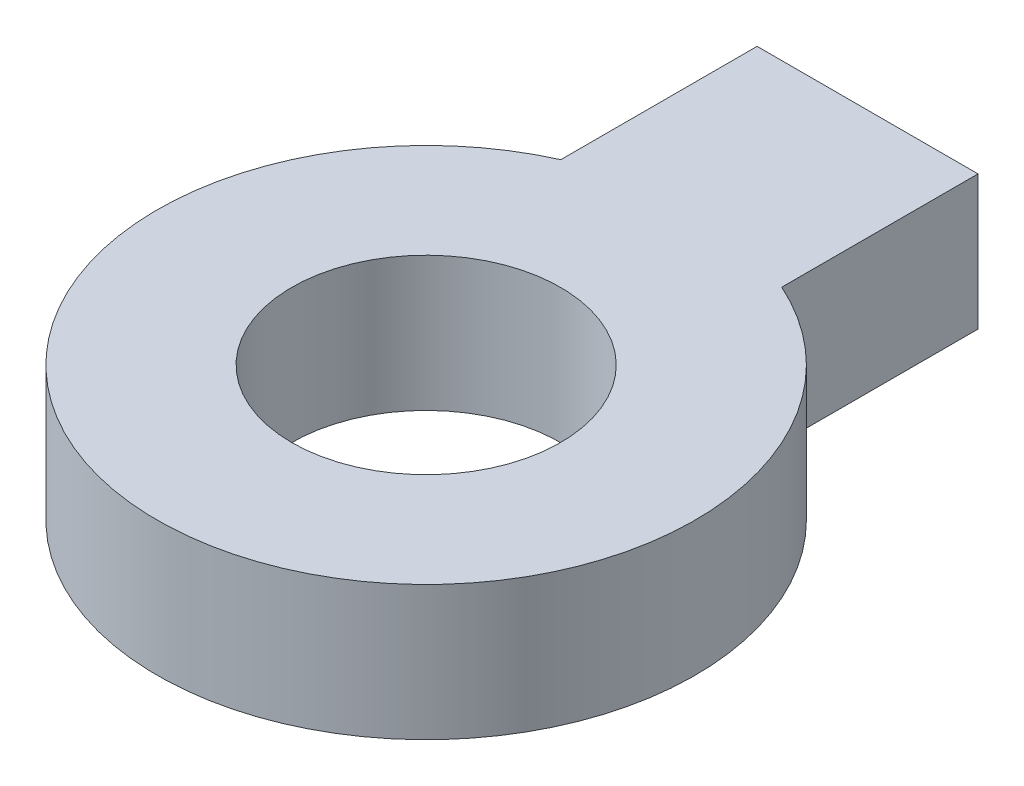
SolidWorks part; units mm, degrees
ref_plane "Front Plane" through (0, 0, 0) normal (0, 0, 1) x (1, 0, 0)
ref_plane "Top Plane" through (0, 0, 0) normal (0, 1, 0) x (1, 0, 0)
ref_plane "Right Plane" through (0, 0, 0) normal (1, 0, 0) x (0, 0, -1)
sketch "Sketch1" plane through (0, 0, 0) normal (0, 1, 0) x (1, 0, 0)
  line L0 (-2.6085, 10.4244) -> (2.6085, 10.4244)
  line L2 (-2.6085, 10.4244) -> (-2.6085, 5.7895)
  line L4 (2.6085, 10.4244) -> (2.6085, 5.7895)
  line L6 (-2.6085, 5.0546) -> (-0.8371, 10.4244) construction
  circle A0 centre (0, 0) radius 3.175
  arc A1 (-2.6085, 5.7895) -> (2.6085, 5.7895) centre (0, 0) ccw
  point P4 (0, 12.9618)
extrude "Boss-Extrude1" add sketch "Sketch1" along normal blind 3.175
